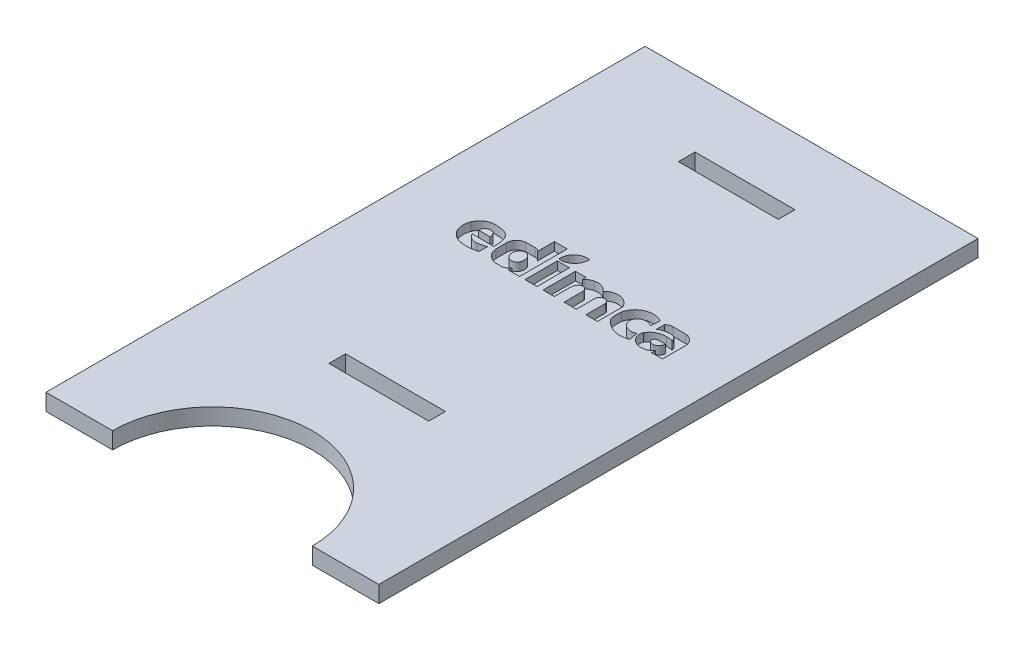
SolidWorks part; units mm, degrees
ref_plane "Alzado" through (0, 0, 0) normal (0, 0, 1) x (1, 0, 0)
ref_plane "Planta" through (0, 0, 0) normal (0, 1, 0) x (1, 0, 0)
ref_plane "Vista lateral" through (0, 0, 0) normal (1, 0, 0) x (0, 0, -1)
sketch "Croquis1" plane through (0, 0, 0) normal (0, 1, 0) x (1, 0, 0)
  line L1 (305.5164, -130.9064) -> (285.5164, -130.9064)
  line L2 (365.5164, -130.9064) -> (385.5164, -130.9064)
  line L8 (320.5164, -80.9064) -> (350.5164, -80.9064)
  line L10 (285.5164, -130.9064) -> (285.5164, 49.0936)
  line L11 (285.5164, 49.0936) -> (385.5164, 49.0936)
  line L12 (385.5164, -130.9064) -> (385.5164, 49.0936)
  line L13 (350.5164, -80.9064) -> (350.5164, -75.9064)
  line L14 (350.5164, -75.9064) -> (320.5164, -75.9064)
  line L15 (320.5164, -75.9064) -> (320.5164, -80.9064)
  line L17 (320.5164, 24.0936) -> (320.5164, 29.0936)
  line L18 (350.5164, 24.0936) -> (320.5164, 24.0936)
  line L19 (350.5164, 29.0936) -> (350.5164, 24.0936)
  line L20 (320.5164, 29.0936) -> (350.5164, 29.0936)
  arc A0 (305.5164, -130.9064) -> (365.5164, -130.9064) centre (335.5164, -130.9064) cw
  point P0 (-30.909, -85.6617)
  point P1 (-30.909, 14.3383)
  point P2 (39.8017, 85.049)
  point P3 (210.5124, 14.3383)
  point P4 (139.8017, 85.049)
  point P6 (210.5124, -85.6617)
  point P7 (139.8017, -156.3724)
  point P8 (39.8017, -156.3724)
  point P14 (-35.909, -85.6617)
  point P17 (-35.909, 16.4093)
  point P22 (37.7306, 90.049)
  point P23 (141.8728, 90.049)
  point P24 (214.0479, 17.8738)
  point P25 (214.0479, -89.1973)
  point P26 (141.8728, -161.3724)
  point P27 (37.7306, -161.3724)
  point P28 (-34.4445, -89.1973)
  point P29 (215.5124, 14.3383)
  point P30 (215.5124, -85.6617)
  point P36 (-30.909, -20.6617)
  point P37 (210.5124, -20.6617)
  point P38 (210.5124, -50.6617)
  point P39 (-30.909, -50.6617)
  point P40 (164.5504, -131.6237)
  point P41 (-6.1602, 39.087)
  point P42 (15.053, 60.3002)
  point P43 (185.7636, -110.4105)
  dimension "D6" = 20
  dimension "D7" = 100
  dimension "D14" = 100
  dimension "D15" = 5
  dimension "D16" = 180
  dimension "D18" = 35
extrude "Saliente-Extruir1" add sketch "Croquis1" along normal blind 5
sketch "Croquis2" plane through (0, 5, 0) normal (0, 1, 0) x (1, 0, 0)
  line L0 (327.5524, -26.4538) -> (561.5524, -26.4538) construction
  line L1 (336.965, -29.6404) -> (336.965, -24.6201)
  line L2 (343.5735, -29.6404) -> (343.5735, -24.0649)
  line L3 (360.8233, -20.3291) -> (360.8233, -22.8272)
  line L4 (366.2286, -28.5048) -> (366.2286, -29.6404)
  line L5 (366.2286, -29.6404) -> (369.4492, -29.6404)
  line L6 (369.4492, -29.6404) -> (369.4492, -22.8272)
  line L7 (313.9461, -26.7381) -> (313.9461, -29.2323)
  line L8 (308.3622, -25.6791) -> (314.9104, -25.6791)
  line L9 (336.7503, -19.9001) -> (336.7503, -20.9842)
  line L10 (358.9856, -26.796) -> (359.45, -29.4631)
  line L11 (358.9856, -22.8272) -> (359.2314, -20.102)
  line L12 (366.4747, -19.6634) -> (362.6572, -19.6634)
  line L13 (366.0975, -25.3407) -> (363.9446, -25.3407)
  line L14 (311.7902, -23.7564) -> (308.3622, -23.7564)
  line L19 (322.6698, -15.3329) -> (326.5306, -15.3329)
  line L20 (326.5306, -15.3329) -> (326.5306, -29.6404)
  line L21 (326.5306, -29.6404) -> (323.124, -29.6404)
  line L22 (323.124, -29.6404) -> (323.124, -28.5048)
  line L24 (321.1824, -29.7599) -> (319.5235, -29.7599)
  line L25 (315.8005, -26.0067) -> (315.8005, -22.8272)
  line L26 (318.6252, -19.7956) -> (321.3231, -19.7956)
  line L27 (322.6698, -20.3291) -> (322.6698, -15.3329)
  line L28 (328.1534, -19.9001) -> (331.754, -19.9001)
  line L29 (331.754, -19.9001) -> (331.754, -29.6404)
  line L30 (331.754, -29.6404) -> (328.1534, -29.6404)
  line L31 (328.1534, -29.6404) -> (328.1534, -19.9001)
  line L33 (349.9223, -21.9997) -> (349.9223, -29.6404)
  line L34 (349.9223, -29.6404) -> (346.4547, -29.6404)
  line L35 (346.4547, -29.6404) -> (346.4547, -23.7564)
  line L36 (343.5735, -29.6404) -> (339.8993, -29.6404)
  line L37 (339.8993, -29.6404) -> (339.8993, -23.8135)
  line L38 (336.965, -29.6404) -> (333.5808, -29.6404)
  line L39 (333.5808, -29.6404) -> (333.5808, -19.9001)
  line L40 (333.5808, -19.9001) -> (336.7503, -19.9001)
  arc A0 (304.9556, -26.5649) -> (309.0589, -29.6404) centre (309.6617, -24.5611) ccw
  arc A1 (308.3622, -23.7564) -> (311.7902, -23.7564) centre (310.0762, -23.5995) cw
  arc A2 (308.3622, -25.6791) -> (311.4107, -27.3421) centre (310.9802, -24.5056) ccw
  arc A3 (311.4107, -27.3421) -> (313.9461, -26.7381) centre (309.0589, -11.8462) ccw
  arc A4 (309.0589, -29.6404) -> (313.9461, -29.2323) centre (310.62, -18.8663) ccw
  arc A5 (315.8005, -22.8272) -> (318.6252, -19.7956) centre (318.8111, -22.8007) cw
  arc A6 (315.8005, -26.0067) -> (319.5235, -29.7599) centre (319.8871, -25.676) ccw
  arc A7 (321.1824, -29.7599) -> (323.124, -28.5048) centre (321.0549, -27.4332) ccw
  arc A8 (327.852, -19.1553) -> (332.6568, -14.7439) centre (328.4653, -15.0009) ccw
  arc A9 (327.852, -19.1553) -> (332.6568, -14.7439) centre (331.9242, -18.7683) cw
  arc A10 (336.965, -24.6201) -> (338.0406, -22.8007) centre (339.0416, -24.6201) cw
  arc A11 (338.0406, -22.8007) -> (339.8993, -23.8135) centre (338.5887, -24.0067) cw
  arc A12 (343.5735, -24.0649) -> (346.4547, -23.7564) centre (345.0306, -24.0649) cw
  arc A13 (336.7503, -20.9842) -> (338.8357, -19.6634) centre (339.5946, -23.1683) cw
  arc A14 (338.8357, -19.6634) -> (342.9164, -20.9842) centre (339.9269, -23.2562) cw
  arc A15 (342.9164, -20.9842) -> (349.9223, -21.9997) centre (346.0793, -23.8383) cw
  arc A16 (359.2314, -20.102) -> (351.0631, -23.5995) centre (356.4149, -24.8112) ccw
  arc A17 (359.45, -29.4631) -> (351.3636, -27.1422) centre (356.94, -22.9609) cw
  arc A18 (351.0631, -23.5995) -> (351.3636, -27.1422) centre (358.4675, -24.7555) ccw
  arc A19 (358.9856, -22.8272) -> (355.0171, -23.2562) centre (357.2158, -25.0259) ccw
  arc A20 (358.9856, -26.796) -> (354.73, -25.5525) centre (357.4796, -24.0465) cw
  arc A21 (355.0171, -23.2562) -> (354.73, -25.5525) centre (356.8264, -24.6485) ccw
  arc A22 (366.2286, -28.5048) -> (360.8233, -29.0396) centre (363.2586, -26.0695) cw
  arc A23 (360.8233, -29.0396) -> (359.722, -25.676) centre (362.4808, -26.6347) cw
  arc A24 (359.722, -25.676) -> (364.2299, -23.2562) centre (363.9269, -28.1007) cw
  arc A25 (364.2299, -23.2562) -> (366.0975, -23.373) centre (364.6944, -30.818) cw
  arc A26 (364.2299, -21.9188) -> (366.0975, -23.373) centre (364.4366, -23.5797) cw
  arc A27 (364.2299, -21.9188) -> (360.8233, -22.8272) centre (363.9446, -27.6904) ccw
  arc A28 (369.4492, -22.8272) -> (366.4747, -19.6634) centre (366.2793, -22.8272) ccw
  arc A29 (362.6572, -19.6634) -> (360.8233, -20.3291) centre (362.6572, -22.5221) ccw
  arc A30 (363.9446, -25.3407) -> (362.8348, -26.4504) centre (363.9446, -26.4504) ccw
  arc A31 (366.0975, -25.3407) -> (364.5755, -27.2509) centre (363.7082, -24.9984) cw
  arc A32 (364.5755, -27.2509) -> (363.2586, -27.0483) centre (364.1077, -25.9108) cw
  arc A33 (363.2586, -27.0483) -> (362.8348, -26.4504) centre (363.7468, -26.2531) cw
  arc A34 (305.0169, -22.6853) -> (304.9556, -26.5649) centre (310.2297, -24.7079) ccw
  arc A35 (321.3231, -19.7956) -> (322.6698, -20.3291) centre (321.3231, -21.7621) cw
  ellipse E0 centre (321.1191, -24.6201) end of major axis (321.3302, -26.796) minor radius 1.8791
  spline S3 degree 3 poles (314.9104, -25.6791) (314.7871, -22.9585) (314.6222, -20.2673) (310.9911, -19.8763) (307.9722, -19.5512) (306.3829, -20.1105) (305.0169, -22.6853) knots 0.049602 0.049602 0.049602 0.049602 1 1 1 2 2 2 2
extrude "Cortar-Extruir1" cut sketch "Croquis2" against normal blind 2.5
